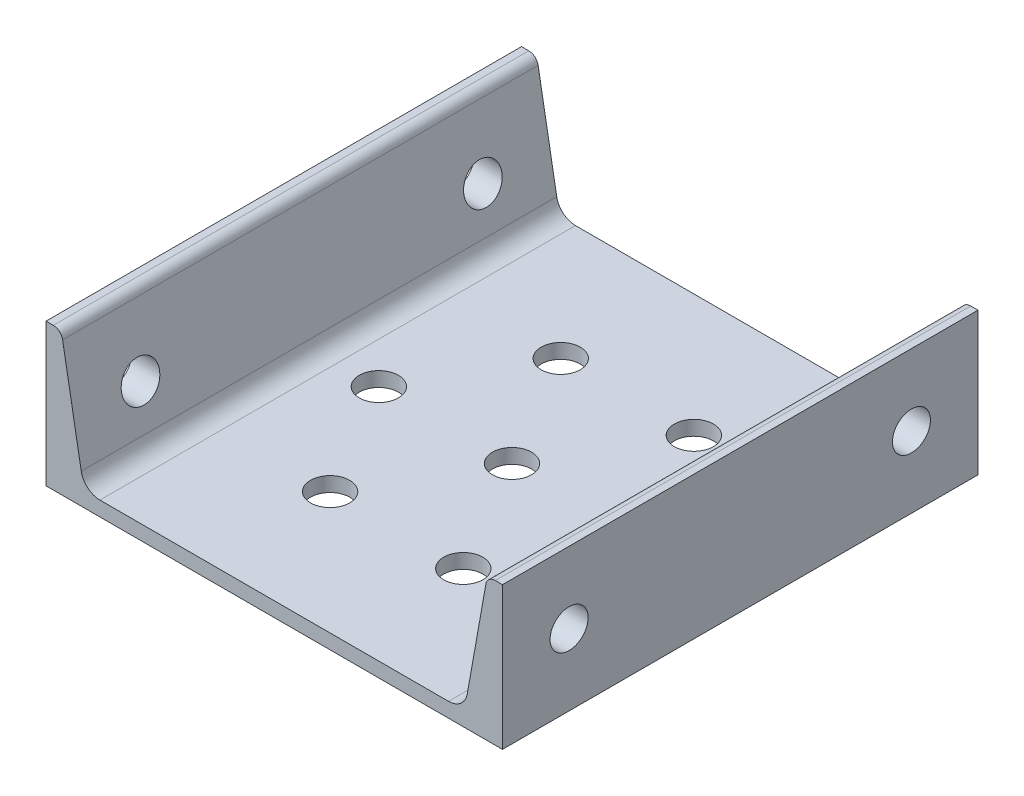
SolidWorks part; units mm, degrees
ref_plane "Front Plane" through (0, 0, 0) normal (0, 0, 1) x (1, 0, 0)
ref_plane "Top Plane" through (0, 0, 0) normal (0, 1, 0) x (1, 0, 0)
ref_plane "Right Plane" through (0, 0, 0) normal (1, 0, 0) x (0, 0, -1)
sketch "Sketch1" plane through (0, 0, 0) normal (0, 0, 1) x (1, 0, 0)
  line L0 (0, 0) -> (0, 47.625)
  line L1 (0, 47.625) -> (2.421, 47.625)
  line L2 (5.5467, 45.0073) -> (11.7665, 10.1248)
  line L3 (18.0179, 4.8895) -> (134.3821, 4.8895)
  line L4 (76.2, 0) -> (76.2, 4.8895) construction
  line L5 (152.4, 0) -> (0, 0)
  line L6 (146.8533, 45.0073) -> (140.6335, 10.1248)
  line L7 (152.4, 47.625) -> (149.979, 47.625)
  line L8 (152.4, 0) -> (152.4, 47.625)
  arc A0 (2.421, 47.625) -> (5.5467, 45.0073) centre (2.421, 44.45) cw
  arc A1 (11.7665, 10.1248) -> (18.0179, 4.8895) centre (18.0179, 11.2395) ccw
  arc A2 (140.6335, 10.1248) -> (134.3821, 4.8895) centre (134.3821, 11.2395) cw
  arc A3 (149.979, 47.625) -> (146.8533, 45.0073) centre (149.979, 44.45) ccw
  point P10 (5.08, 47.625)
  point P13 (12.7, 4.8895)
  point P22 (139.7, 4.8895)
  point P23 (147.32, 47.625)
  dimension "D6" = 3.175
  dimension "D7" = 6.35
  dimension "D1" = 76.2
  dimension "D2" = 47.625
  dimension "D3" = 4.8895
  dimension "D4" = 12.7
  dimension "D5" = 5.08
extrude "Boss-Extrude1" add sketch "Sketch1" against normal blind 158.75 contours L5 L0 L1 A0 L2 A1 L3 A2 L6 A3 L7 L8
sketch "Sketch2" plane through (0, 4.8895, 0) normal (0, 1, 0) x (1, 0, 0)
  line L0 (76.2, 0) -> (76.2, 158.75) construction
  line L1 (134.3821, 0) -> (18.0179, 0) construction
  line L2 (134.3821, 158.75) -> (18.0179, 158.75) construction
  line L3 (0, 79.375) -> (152.4, 79.375) construction
  line L4 (0, 158.75) -> (0, 0) construction
  line L5 (152.4, 158.75) -> (152.4, 0) construction
  line L6 (134.3821, 158.75) -> (134.3821, 0) construction
  circle A0 centre (98.425, 117.8698) radius 6.5405
  circle A1 centre (120.65, 79.375) radius 6.5405
  circle A2 centre (98.425, 40.8802) radius 6.5405
  circle A3 centre (53.975, 40.8802) radius 6.5405
  circle A4 centre (76.2, 79.375) radius 6.5405
  circle A5 centre (53.975, 117.8698) radius 6.5405
  circle A6 centre (31.75, 79.375) radius 6.5405
  dimension "D1" = 13.081
  dimension "D2" = 13.7321
  dimension "D3" = 35.9571
  dimension "D4" = 80.4071
  dimension "D5" = 102.6321
  dimension "D6" = 40.8802
  dimension "D7" = 117.8698
extrude "Cut-Extrude1" cut sketch "Sketch2" against normal through all
sketch "Sketch3" plane through (0, 0, 0) normal (-1, 0, 0) x (0, 0, 1)
  line L0 (-136.525, 23.8125) -> (-22.225, 23.8125) construction
  line L1 (-79.375, 47.625) -> (-79.375, 23.8125) construction
  line L2 (-158.75, 47.625) -> (0, 47.625) construction
  line L3 (-22.225, 23.8125) -> (0, 23.8125) construction
  line L4 (0, 47.625) -> (0, 0) construction
  circle A0 centre (-136.525, 23.8125) radius 6.35
  circle A1 centre (-22.225, 23.8125) radius 6.35
  dimension "D1" = 12.7
  dimension "D2" = 114.3
extrude "Cut-Extrude2" cut sketch "Sketch3" against normal through all
